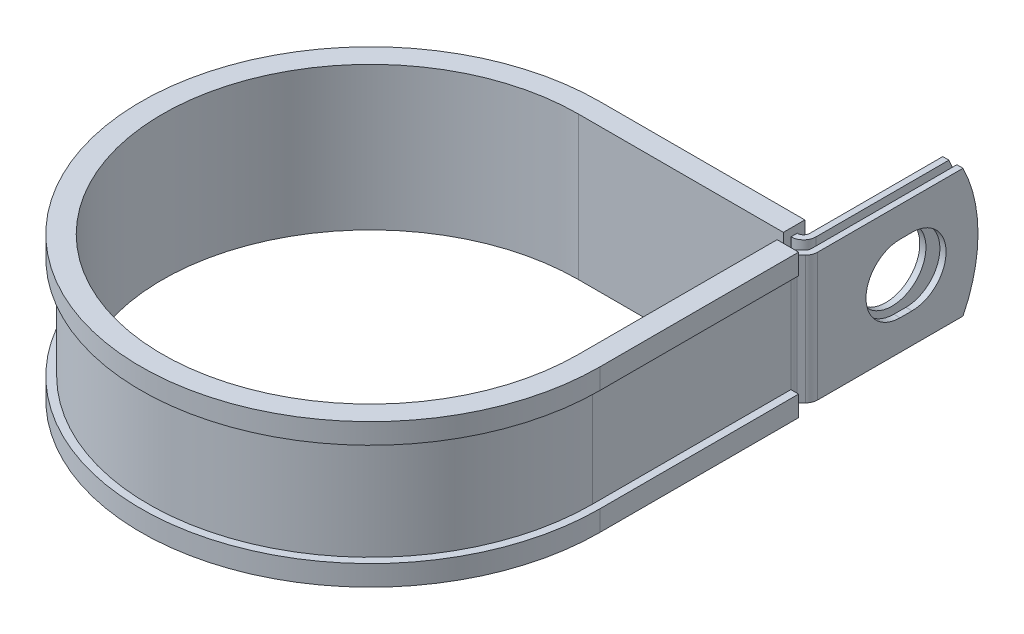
SolidWorks part; units mm, degrees
ref_plane "Front Plane" through (0, 0, 0) normal (0, 0, 1) x (1, 0, 0)
ref_plane "Top Plane" through (0, 0, 0) normal (0, 1, 0) x (1, 0, 0)
ref_plane "Right Plane" through (0, 0, 0) normal (1, 0, 0) x (0, 0, -1)
sketch "Sketch1" plane through (0, 0, 0) normal (0, 1, 0) x (1, 0, 0)
  line L0 (0, 42.799) -> (40.6833, 42.799)
  line L1 (42.799, 0) -> (42.799, 39.3865)
  line L2 (43.1217, 74.5998) -> (43.1217, 45.2374)
  line L3 (43.5132, 41.1107) -> (44.3394, 41.9369)
  line L5 (44.6965, 42.799) -> (44.6965, 74.5998)
  arc A0 (0, 42.799) -> (42.799, 0) centre (0, 0) ccw
  arc A1 (43.5132, 41.1107) -> (42.799, 39.3865) centre (45.2374, 39.3865) ccw
  arc A2 (44.3394, 41.9369) -> (44.6965, 42.799) centre (43.4773, 42.799) ccw
  arc A3 (40.6833, 42.799) -> (43.1217, 45.2374) centre (40.6833, 45.2374) ccw
extrude "Extrude-Thin1" add sketch "Sketch1" along normal mid plane 25.4 thin
sketch "Sketch2" plane through (41.9025, 0, 0) normal (-1, 0, 0) x (0, 0, 1)
  line L0 (-74.5998, 12.7) -> (-74.5998, -12.7) construction
  line L1 (0, 12.7) -> (0, -12.7) construction
  circle A0 centre (-60.325, 0) radius 6.7437
  point P2 (-74.5998, 0)
extrude "Cut-Extrude1" cut sketch "Sketch2" against normal up to surface (1.2192 mm away)
sketch "Sketch3" plane through (45.9157, 0, 0) normal (1, 0, 0) x (0, 0, -1)
  line L0 (59.1312, 0) -> (61.5188, 0) construction
  line L1 (59.1312, 6.7437) -> (61.5188, 6.7437)
  line L2 (59.1312, -6.7437) -> (61.5188, -6.7437)
  line L3 (74.5998, 12.7) -> (74.5998, -12.7) construction
  arc A0 (59.1312, 6.7437) -> (59.1312, -6.7437) centre (59.1312, 0) ccw
  arc A1 (61.5188, -6.7437) -> (61.5188, 6.7437) centre (61.5188, 0) ccw
  point P3 (60.325, 0)
  point P8 (74.5998, 0)
  point P11 (52.3875, 0)
  point P12 (68.2625, 0)
extrude "Cut-Extrude2" cut sketch "Sketch3" against normal up to surface (1.2192 mm away)
sketch "Sketch4" plane through (41.9025, 0, 0) normal (-1, 0, 0) x (0, 0, 1)
  line L0 (-74.5998, 12.7) -> (-74.5998, -12.7)
  line L1 (-74.5998, 12.7) -> (-71.6225, 12.7)
  line L2 (-74.5998, 12.7) -> (-45.2374, 12.7) construction
  line L3 (-74.5998, -12.7) -> (-71.6225, -12.7)
  line L4 (-74.5998, -12.7) -> (-45.2374, -12.7) construction
  arc A0 (-71.6225, 12.7) -> (-71.6225, -12.7) centre (-46.0248, 0) ccw
extrude "Cut-Extrude3" cut sketch "Sketch4" against normal through all contours A0 M4 M5 | A0 L0 M2
ref_plane "Plane1" through (0, 0, -39.3865) normal (0, 0, -1) x (-1, 0, 0)
ref_plane "Plane2" through (40.6325, 0, 0) normal (-1, 0, 0) x (0, 0, 1)
sketch "Sketch5" plane through (0, 0, -39.3865) normal (0, 0, -1) x (-1, 0, 0)
  line L0 (-44.0182, 12.7) -> (-42.799, 12.7)
  line L1 (-44.0182, 12.7) -> (-44.0182, -12.7) construction
  line L3 (-42.799, 12.7) -> (-42.799, -12.7)
  line L4 (-42.799, -12.7) -> (-44.0182, -12.7)
  line L5 (-44.0182, -12.7) -> (-44.0182, -10.16)
  line L6 (-44.0182, 12.7) -> (-44.0182, 10.16)
  line L7 (-45.5422, 14.224) -> (-45.5422, 10.16)
  line L8 (-45.5422, 14.224) -> (-41.275, 14.224)
  line L9 (-41.275, 14.224) -> (-41.275, -14.224)
  line L10 (-41.275, -14.224) -> (-45.5422, -14.224)
  line L11 (-45.5422, -14.224) -> (-45.5422, -10.16)
  line L12 (-45.5422, 10.16) -> (-44.0182, 10.16)
  line L13 (-44.0182, -10.16) -> (-45.5422, -10.16)
sketch "Sketch6" plane through (0, 12.7, 0) normal (0, 1, 0) x (1, 0, 0)
  line L0 (41.275, 0) -> (41.275, 39.3865)
  line L1 (41.275, 39.3865) -> (45.5422, 39.3865) construction
  line L2 (40.6325, 6.9878) -> (40.6325, -6.9878) construction
  line L5 (0, 41.275) -> (40.6325, 41.275)
  arc A0 (0, 41.275) -> (41.275, 0) centre (0, 0) ccw
sweep "Sweep1" add profiles "Sketch5" path "Sketch6"
equation "\"D4@Sketch5\" = \"D1@Extrude-Thin1\""
equation "\"D5@Sketch5\" = \"D5@Extrude-Thin1\""
equation "\"D1@Sketch3\" = \"D2@Sketch2\""
equation "\"D7@Sketch1\" = \"D3@Sketch2\" + \"D1@Sketch3\""
equation "\"D1@Sketch1\" = \"D1@Sketch6\" + 2 * \"D3@Sketch5\""
equation "\"D1@Sketch4\" = ( \"D1@Extrude-Thin1\" + .125 ) * 2"
equation "\"D9@Sketch1\"= \"D5@Extrude-Thin1\""
equation "\"D8@Sketch1\"= 2 * \"D5@Extrude-Thin1\""
equation "\"D2@Sketch1\" = 2 * \"D5@Extrude-Thin1\""
equation "\"D2@Sketch3\" = \"D1@Sketch2\""
